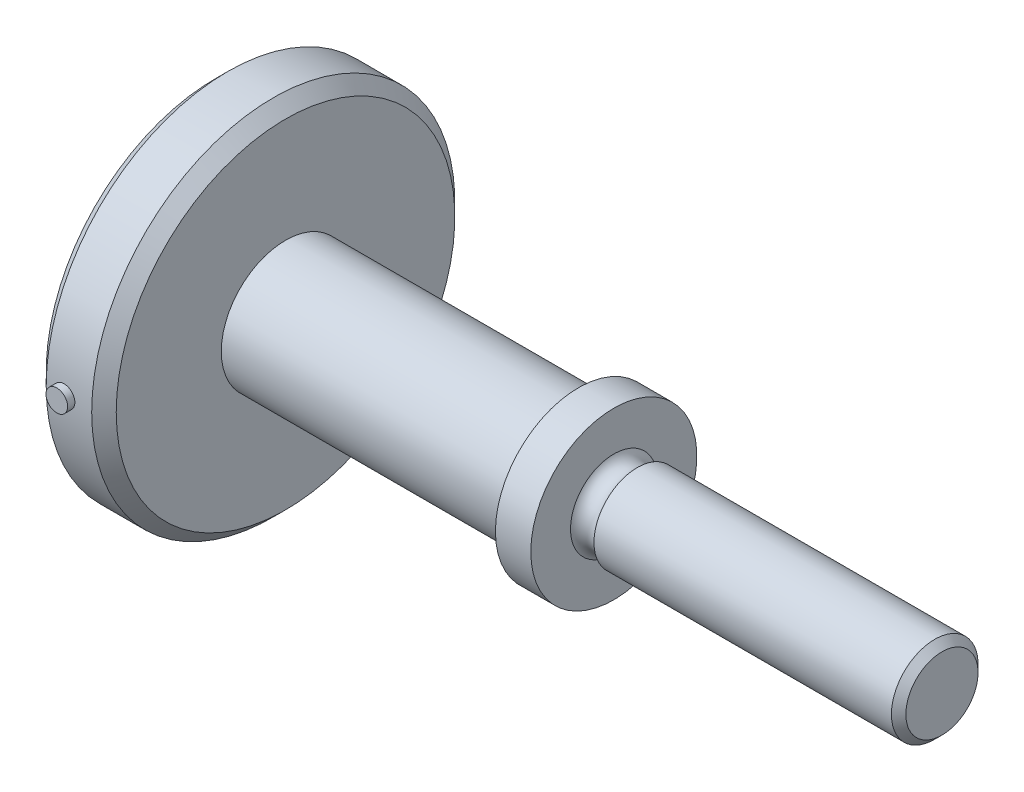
SolidWorks part; units mm, degrees
ref_plane "Front Plane" through (0, 0, 0) normal (0, 0, 1) x (1, 0, 0)
ref_plane "Top Plane" through (0, 0, 0) normal (0, 1, 0) x (1, 0, 0)
ref_plane "Right Plane" through (0, 0, 0) normal (1, 0, 0) x (0, 0, -1)
sketch "Sketch1" plane through (0, 0, 0) normal (0, 0, 1) x (1, 0, 0)
  line L0 (0, 0) -> (0, 6)
  line L1 (0, 6) -> (-42.2, 6)
  line L2 (-45.45, 6) -> (-45.45, 8.9)
  line L4 (-45.45, 8.9) -> (-45.45, 11.5)
  line L5 (-45.45, 11.5) -> (-50.35, 11.5)
  line L6 (-90.92, 25.15) -> (-90.92, 8.9)
  line L7 (-90.92, 25.15) -> (-100.62, 25.15)
  line L8 (-100.62, 25.15) -> (-100.62, 0)
  line L9 (-100.62, 0) -> (0, 0)
  line L11 (-90.92, 8.9) -> (-50.35, 8.9)
  line L12 (-50.35, 8.9) -> (-50.35, 11.5)
  arc A0 (-42.2, 6) -> (-45.45, 6) centre (-43.825, 6.7742) cw
  dimension "D10" = 1.8
  dimension "D1" = 42.2
  dimension "D2" = 6
  dimension "D3" = 25.15
  dimension "D4" = 9.7
  dimension "D5" = 8.9
  dimension "D6" = 40.57
  dimension "D7" = 4.9
  dimension "D8" = 11.5
  dimension "D9" = 3.25
revolve "Revolve1" add sketch "Sketch1" angle 360 about L9
chamfer "Chamfer1" distance 1.7 angle 45 1 edges at (-100.62, 0, 25.15)
chamfer "Chamfer2" distance 1.7 angle 45 1 edges at (-90.92, 0, 25.15)
chamfer "Chamfer3" distance 1 angle 45 1 edges at (0, 0, 6)
ref_plane "Plane1" through (0, 0, 25.15) normal (0, 0, 1) x (1, 0, 0)
sketch "Sketch2" plane through (0, 0, 25.15) normal (0, 0, 1) x (1, 0, 0)
  line L0 (-100.62, 23.45) -> (-100.62, -23.45) construction
  line L3 (-50.35, 0) -> (-90.92, 0) construction
  circle A0 centre (-96.4496, 0) radius 1.5
  dimension "D1" = 3
  dimension "D2" = 4.1704
extrude "Boss-Extrude1" add sketch "Sketch2" along normal blind 1 separate body
